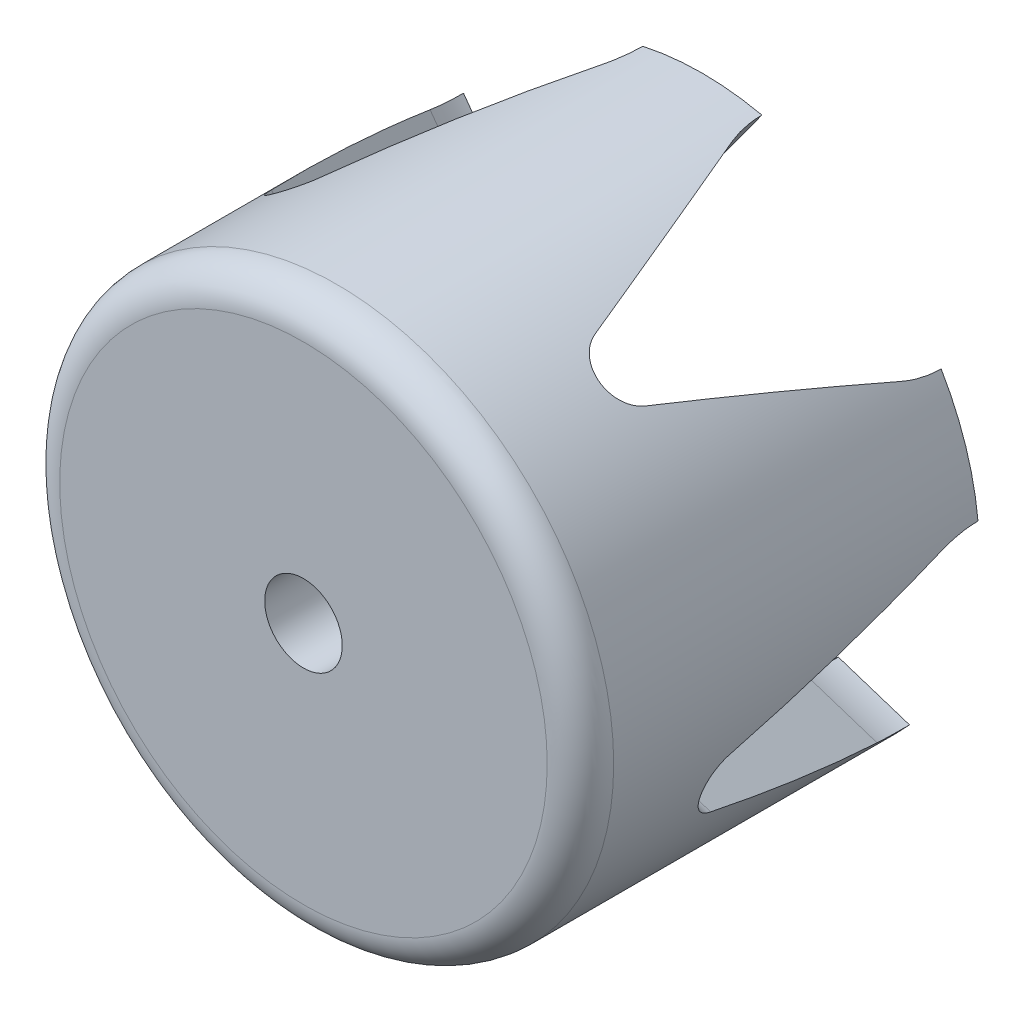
SolidWorks part; units mm, degrees
ref_plane "Front Plane" through (0, 0, 0) normal (0, 0, 1) x (1, 0, 0)
ref_plane "Top Plane" through (0, 0, 0) normal (0, 1, 0) x (1, 0, 0)
ref_plane "Right Plane" through (0, 0, 0) normal (1, 0, 0) x (0, 0, -1)
sketch "Sketch1" plane through (0, 0, 0) normal (0, 0, 1) x (1, 0, 0)
  circle A0 centre (0, 0) radius 12.5
  circle A1 centre (0, 0) radius 9.5
  dimension "D1" = 25
  dimension "D2" = 3
extrude "Boss-Extrude1" add sketch "Sketch1" along normal blind 15
sketch "Sketch2" plane through (0, 0, 15) normal (0, 0, 1) x (1, 0, 0)
  circle A0 centre (0, 0) radius 12.5
extrude "Boss-Extrude2" add sketch "Sketch2" along normal blind 3
sketch "Sketch3" plane through (0, 0, 18) normal (0, 0, 1) x (1, 0, 0)
  circle A0 centre (0, 0) radius 1.75
  dimension "D1" = 3.5
extrude "Cut-Extrude1" cut sketch "Sketch3" against normal through all
fillet "Fillet1" radius 1.5 1 edges at (12.5, 0, 18)
sketch "Sketch4" plane through (0, 0, 0) normal (0, 1, 0) x (1, 0, 0)
  line L0 (1.75, -15) -> (-1.75, -15) construction
  line L1 (1.75, -15) -> (-1.75, -15)
  line L2 (-4.714, -1.6667) -> (-1.4142, -11)
  line L3 (1.4142, -11) -> (4.714, -1.6667)
  arc A0 (4.714, -1.6667) -> (-4.714, -1.6667) centre (0, 0) ccw
  arc A1 (-1.4142, -11) -> (1.4142, -11) centre (0, -10.5) ccw
  dimension "D1" = 10
  dimension "D2" = 3
extrude "Cut-Extrude2" cut sketch "Sketch4" against normal through all contours A0 L2 A1 L3
sketch3d "3DSketch2"
  line L0 (0, 0, 18) -> (0, 0, 0) construction
  line L1 (0, 0, 15) -> (0, 0, 18) construction
pattern_circular "CirPattern1" count 5 over 360 about axis through (0, 0, 0) along (0, 0, 1) of "Cut-Extrude2"
